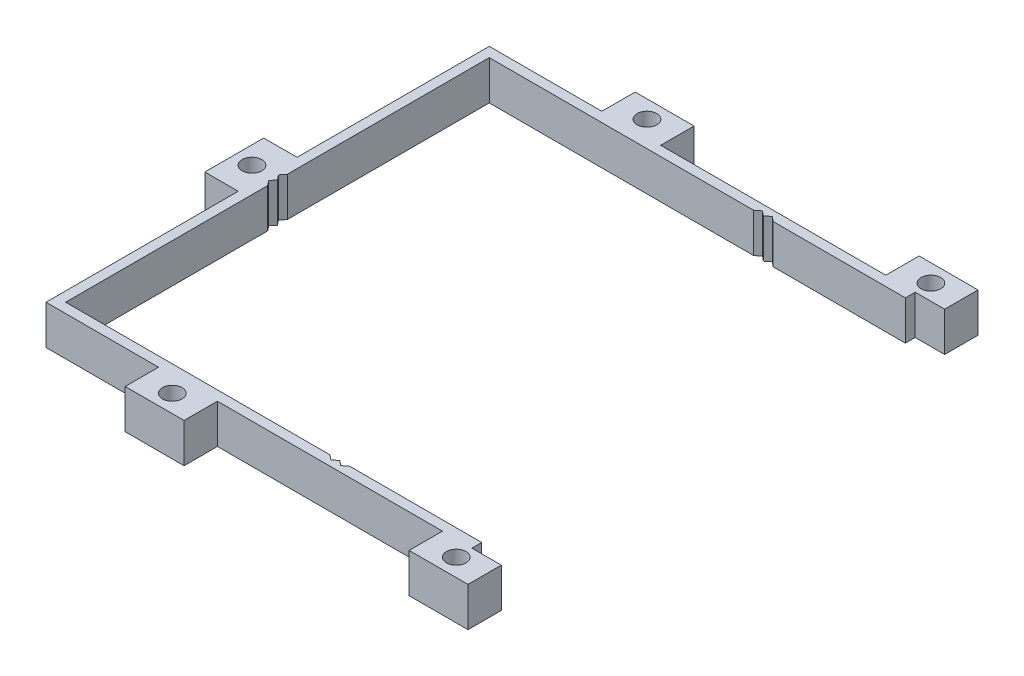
SolidWorks part; units mm, degrees
ref_plane "Front Plane" through (0, 0, 0) normal (0, 0, 1) x (1, 0, 0)
ref_plane "Top Plane" through (0, 0, 0) normal (0, 1, 0) x (1, 0, 0)
ref_plane "Right Plane" through (0, 0, 0) normal (1, 0, 0) x (0, 0, -1)
body saved out of another part "Stock-Frame-1"
